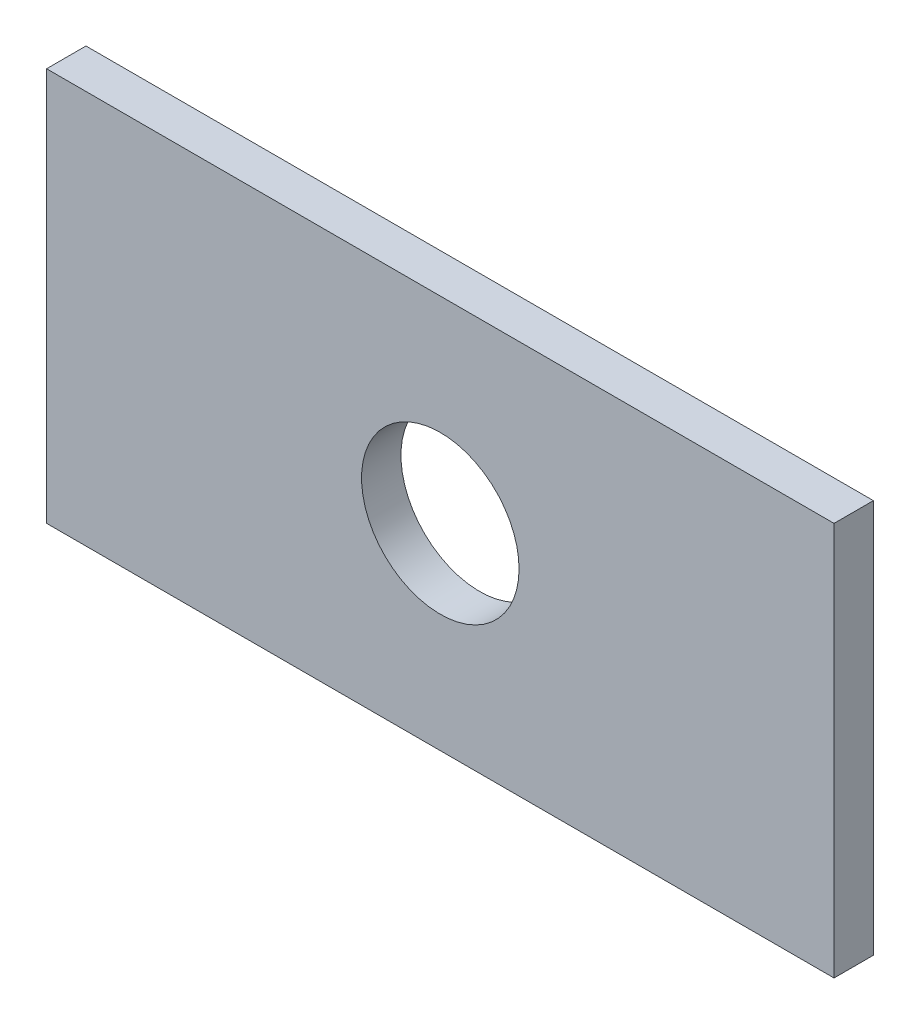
SolidWorks part; units mm, degrees
ref_plane "Front" through (0, 0, 0) normal (0, 0, 1) x (1, 0, 0)
ref_plane "Top" through (0, 0, 0) normal (0, 1, 0) x (1, 0, 0)
ref_plane "Right" through (0, 0, 0) normal (1, 0, 0) x (0, 0, -1)
sketch "Sketch1" plane through (0, 0, 0) normal (0, 0, 1) x (1, 0, 0)
  line L1 (0, 0) -> (100, 0)
  line L2 (0, 0) -> (0, 50)
  line L3 (0, 50) -> (100, 50)
  line L4 (100, 0) -> (100, 50)
  dimension "D1" = 100
  dimension "D2" = 50
extrude "Base-Extrude" add sketch "Sketch1" along normal blind 5
sketch "Sketch3" plane through (0, 0, 5) normal (0, 0, 1) x (1, 0, 0)
  line L0 (100, 0) -> (100, 50) construction
  line L1 (0, 0) -> (100, 0) construction
  circle A0 centre (50, 25) radius 10
  dimension "right" = 20
  dimension "D3" = 25
  dimension "D2" = 50
extrude "Cut-Extrude2" cut sketch "Sketch3" against normal through all
equation "\"D2@Sketch3\" = .5*\"D1@Sketch1\""
equation "\"D3@Sketch3\" = .5*\"D2@Sketch1\""
